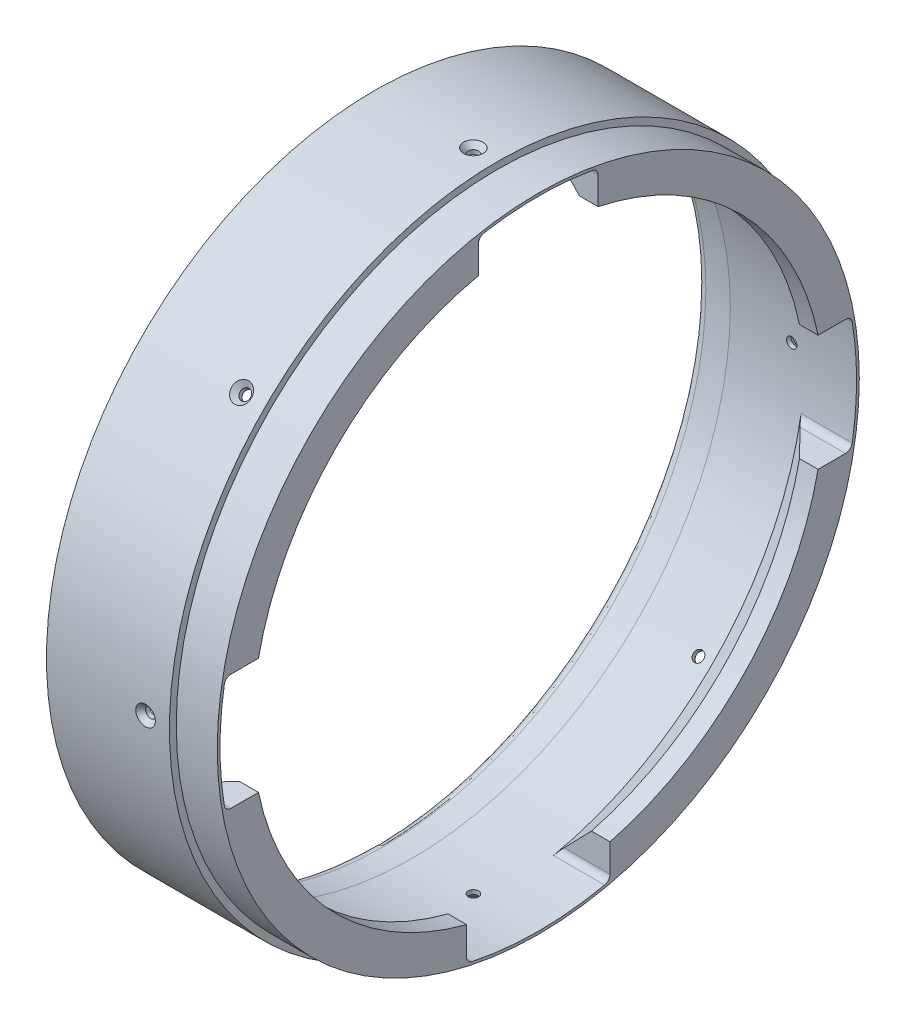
SolidWorks part; units mm, degrees
ref_plane "Front Plane" through (0, 0, 0) normal (0, 0, 1) x (1, 0, 0)
ref_plane "Top Plane" through (0, 0, 0) normal (0, 1, 0) x (1, 0, 0)
ref_plane "Right Plane" through (0, 0, 0) normal (1, 0, 0) x (0, 0, -1)
sketch "Sketch1" plane through (0, 0, 0) normal (0, 0, 1) x (1, 0, 0)
  line L0 (72.3301, 132.8257) -> (57.2008, 147.955)
  line L1 (57.2008, 147.955) -> (22.2758, 147.955)
  line L2 (61.9125, 149.225) -> (80.9625, 149.225)
  line L3 (61.9125, 149.225) -> (61.9125, 152.4)
  line L4 (80.9625, 149.225) -> (80.9625, 132.8257)
  line L5 (61.9125, 152.4) -> (4.7625, 152.4)
  line L6 (0, 0) -> (-35.5981, 0) construction
  line L7 (57.2008, -147.955) -> (22.2758, -147.955) construction
  line L8 (80.9625, 132.8257) -> (72.3301, 132.8257)
  line L9 (9.3207, 149.5457) -> (22.2758, 147.955)
  arc A0 (4.7625, 152.4) -> (9.3207, 149.5457) centre (10.0946, 155.8483) ccw
  dimension "D6" = 6.35
  dimension "D11" = 3.4483
  dimension "D9" = 23.7617
  dimension "D14" = 4.7625
  dimension "D1" = 61.9125
  dimension "D2" = 295.91
  dimension "D3" = 45
  dimension "D4" = 34.925
  dimension "D5" = 22.2758
  dimension "D7" = 152.4
  dimension "D8" = 57.15
  dimension "D10" = 5.3321
  dimension "D12" = 149.225
  dimension "D13" = 132.8257
  dimension "D15" = 19.05
  dimension "D16" = 7
  dimension "D17" = 52.4383
revolve "Revolve1" add sketch "Sketch1" angle 360 about L6
hole_wizard "CSK for #8 Flat Head Socket Cap Screw (custom)1" positions "3DSketch2" profile "Sketch4" countersink size "#8" standard "ANSI Inch"
sketch3d "3DSketch2"
  point P0 (50.8, 152.4, 0)
sketch "Sketch4" plane through (50.8, 152.4, 0) normal (1, 0, 0) x (0, 0, 1)
  line L0 (0, 0) -> (0, 361.6414)
  line L1 (0, 361.6414) -> (2.413, 361.6414)
  line L2 (2.413, 361.6414) -> (2.413, 2.4646)
  line L3 (2.413, 2.4646) -> (4.5554, 0)
  line L5 (4.5554, 0) -> (0, 0)
  line L6 (-2.413, 2.4646) -> (-4.5554, 0) construction
  line L11 (0, -6.35) -> (0, 107.95) construction
  dimension "Thru Hole Dia." = 4.826
  dimension "Thru Hole Depth" = 361.6414
  dimension "Near C'Sink Dia." = 9.1108
  dimension "Near C'Sink Angle" = 82
pattern_circular "CirPattern1" count 8 over 360 about axis through (0, 0, 0) along (1, 0, 0) of "CSK for #8 Flat Head Socket Cap Screw (custom)1"
sketch3d "CenterOfMass 12/09/2008 10:37:52"
  point P0 (53.973, 0, 0)
sketch "Sketch5" plane through (0, 0, 0) normal (1, 0, 0) x (0, 0, -1)
  line L0 (-147.955, 0) -> (0, 0) construction
  line L5 (142.8083, 26.9875) -> (-142.8083, 26.9875)
  line L7 (142.8083, -26.9875) -> (-142.8083, -26.9875)
  line L9 (0, 19.8734) -> (0, 0) construction
  circle A0 centre (0, 0) radius 147.955 construction
  arc A1 (-145.9401, 24.3347) -> (-145.9401, -24.3347) centre (0, 0) ccw
  arc A2 (145.9401, -24.3347) -> (145.9401, 24.3347) centre (0, 0) ccw
  arc A3 (142.8083, -26.9875) -> (145.9401, -24.3347) centre (142.8083, -23.8125) ccw
  arc A4 (142.8083, 26.9875) -> (145.9401, 24.3347) centre (142.8083, 23.8125) cw
  arc A5 (-142.8083, -26.9875) -> (-145.9401, -24.3347) centre (-142.8083, -23.8125) cw
  arc A6 (-142.8083, 26.9875) -> (-145.9401, 24.3347) centre (-142.8083, 23.8125) ccw
  point P6 (145.4729, -26.9875)
  dimension "D1" = 3.175
  dimension "D2" = 53.975
extrude "FlowSlotCut" cut sketch "Sketch5" along normal through all
sketch "Sketch6" plane through (0, 0, 0) normal (1, 0, 0) x (0, 0, -1)
  line L0 (0, 67.2366) -> (0, 0) construction
  line L2 (27.7812, 142.6737) -> (27.7812, 67.2366)
  line L3 (27.7812, 67.2366) -> (-27.7812, 67.2366)
  line L4 (-27.7813, 142.6737) -> (-27.7812, 67.2366)
  circle A0 centre (0, 0) radius 147.955 construction
  arc A1 (25.1459, 145.8025) -> (-25.1459, 145.8025) centre (0, 0) ccw
  arc A2 (27.7812, 142.6737) -> (25.1459, 145.8025) centre (24.6062, 142.6737) ccw
  arc A3 (-27.7813, 142.6737) -> (-25.1459, 145.8025) centre (-24.6063, 142.6737) cw
  dimension "D2" = 3.175
  dimension "D1" = 55.5625
extrude "Top Cut" cut sketch "Sketch6" along normal through all
sketch "Sketch7" plane through (0, 0, 0) normal (1, 0, 0) x (0, 0, -1)
  line L0 (0, -51.436) -> (0, 0) construction
  line L1 (33.3375, -51.436) -> (-33.3375, -51.436)
  line L2 (33.3375, -51.436) -> (33.3375, -141.6032)
  line L4 (-33.3375, -51.436) -> (-33.3375, -141.6032)
  circle A0 centre (0, 0) radius 147.955 construction
  arc A1 (-30.824, -144.7086) -> (30.824, -144.7086) centre (0, 0) ccw
  arc A2 (33.3375, -141.6032) -> (30.824, -144.7086) centre (30.1625, -141.6032) cw
  arc A3 (-33.3375, -141.6032) -> (-30.824, -144.7086) centre (-30.1625, -141.6032) ccw
  dimension "D2" = 3.175
  dimension "D1" = 66.675
extrude "Puck Cut" cut sketch "Sketch7" along normal through all
sketch "Sketch8" [suppressed] plane through (0, 0, 0) normal (1, 0, 0) x (0, 0, -1)
  line L0 (-68.3664, 98.8129) -> (-109.1834, 50.1691)
  line L1 (-88.7749, 74.491) -> (0, 0) construction
  line L2 (0, 0) -> (0, 107.6911) construction
  line L3 (-68.3664, 98.8129) -> (-88.3178, 115.5541)
  line L4 (-109.1834, 50.1691) -> (-129.1348, 66.9103)
  arc A0 (-129.1348, 66.9103) -> (-129.8811, 70.8631) centre (-127.0939, 69.3425) cw
  arc A1 (-88.3178, 115.5541) -> (-92.3402, 115.6027) centre (-90.3586, 113.1219) ccw
  circle A2 centre (0, 0) radius 147.955 construction
  arc A3 (-92.3402, 115.6027) -> (-129.8811, 70.8631) centre (0, 0) ccw
  dimension "D2" = 3.175
  dimension "D1" = 50
  dimension "D3" = 115.8874
  dimension "D5" = 63.5
extrude "SeaBird Pump Cut" [suppressed] cut sketch "Sketch8" along normal through all
equation "\"Buoyancy\"=\"SW-Volume\"*(\"SW-Density\"-.037062)"
